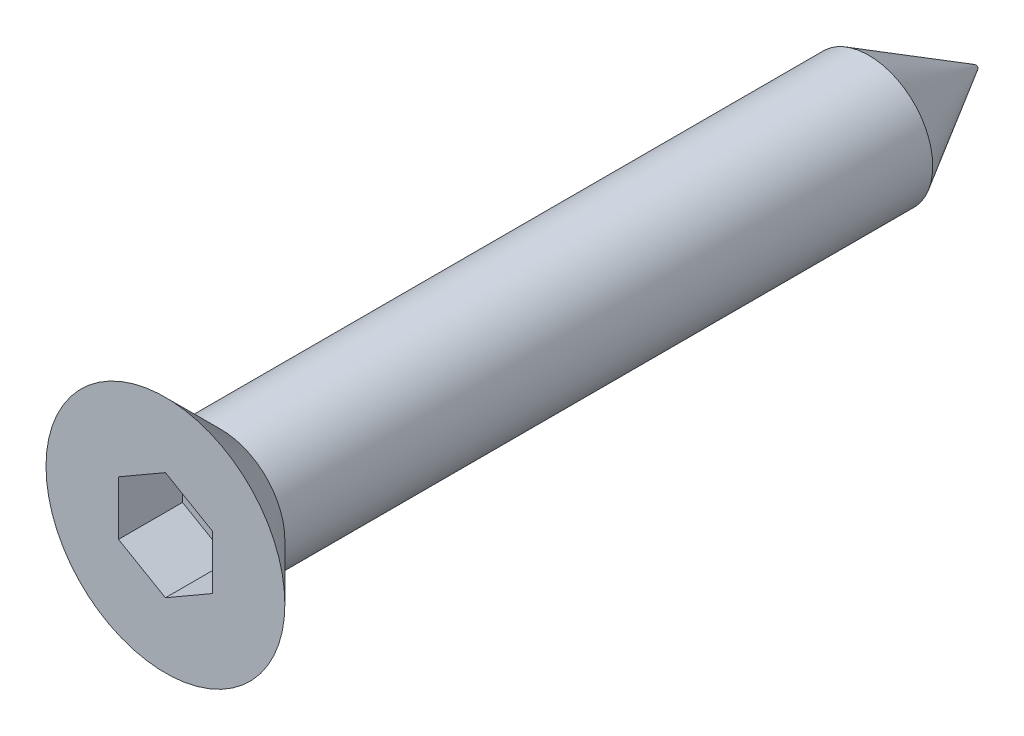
SolidWorks part; units mm, degrees
ref_plane "Plan de face" through (0, 0, 0) normal (0, 0, 1) x (1, 0, 0)
ref_plane "Plan de dessus" through (0, 0, 0) normal (0, 1, 0) x (1, 0, 0)
ref_plane "Plan de droite" through (0, 0, 0) normal (1, 0, 0) x (0, 0, -1)
sketch "Esquisse1" plane through (0, 0, 0) normal (1, 0, 0) x (0, 0, -1)
  line L0 (-1.6035, 0) -> (7.1529, 0) construction
  line L1 (0, 5.0438) -> (0, -4.594) construction
  line L2 (0, 2.8) -> (1.3, 1.5)
  line L3 (1.3, 1.5) -> (1.3, 0)
  line L4 (-1.442, 2.8) -> (2.7621, 2.8) construction
  line L5 (0, 2.8) -> (8.0274, -5.2274) construction
  line L6 (-1.0988, 1.5) -> (4.1029, 1.5) construction
  line L7 (1.3, 0) -> (0, 0)
  line L9 (0, 2.8) -> (0, 0)
revolve "Révolution2" add sketch "Esquisse1" angle 360 about L0
sketch "Esquisse3" plane through (0, 0, 0) normal (0, 0, 1) x (1, 0, 0)
  circle A0 centre (0, 0) radius 1.5
extrude "Extrusion1" add sketch "Esquisse3" against normal blind 19
sketch "Esquisse2" plane through (0, 0, 0) normal (0, 0, 1) x (1, 0, 0)
  line L1 (0, 1.2702) -> (-1.1, 0.6351)
  line L2 (-1.1, 0.6351) -> (-1.1, -0.6351)
  line L3 (-1.1, -0.6351) -> (0, -1.2702)
  line L4 (0, -1.2702) -> (1.1, -0.6351)
  line L5 (1.1, -0.6351) -> (1.1, 0.6351)
  line L6 (1.1, 0.6351) -> (0, 1.2702)
  circle A0 centre (0, 0) radius 1.8 construction
  circle A1 centre (0, 0) radius 1.1 construction
extrude "Enlèv. mat.-Extru.2" cut sketch "Esquisse2" against normal blind 1.5
chamfer "Chanfrein1" distance 1.45 angle 60 1 edges at (1.5, 0, -19)
